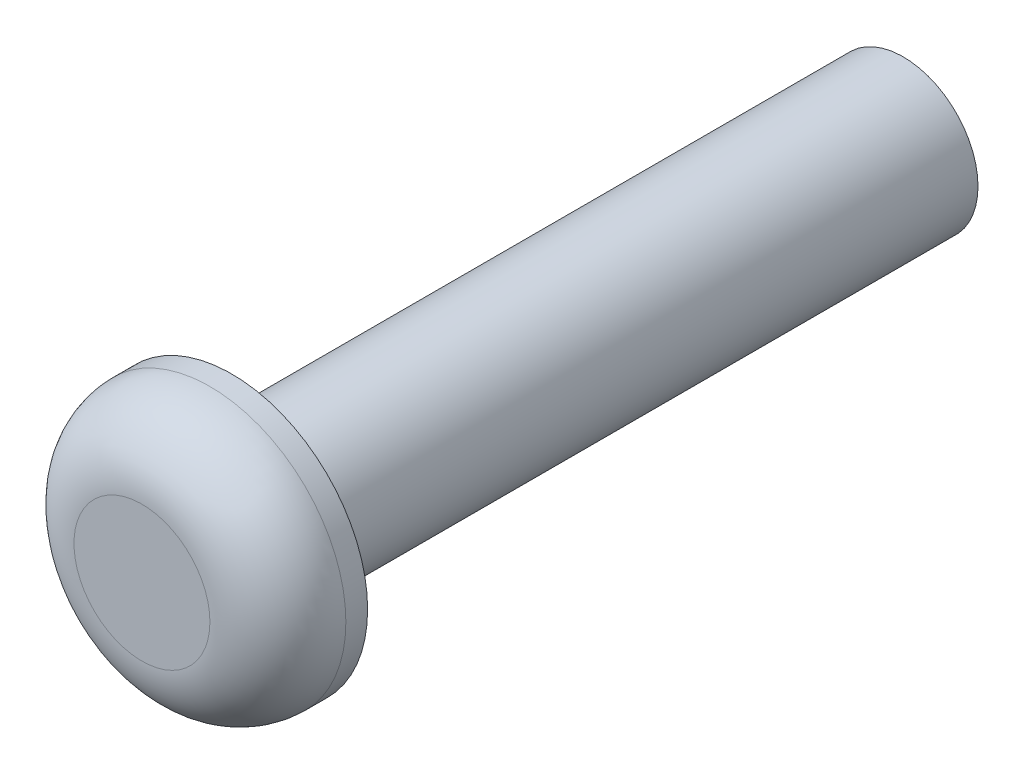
SolidWorks part; units mm, degrees
ref_plane "Front Plane" through (0, 0, 0) normal (0, 0, 1) x (1, 0, 0)
ref_plane "Top Plane" through (0, 0, 0) normal (0, 1, 0) x (1, 0, 0)
ref_plane "Right Plane" through (0, 0, 0) normal (1, 0, 0) x (0, 0, -1)
sketch "Sketch1" plane through (0, 0, 0) normal (0, 0, 1) x (1, 0, 0)
  circle A0 centre (0, 0) radius 2.54
  dimension "D1" = 5.08
extrude "Boss-Extrude1" add sketch "Sketch1" along normal blind 1.6764
sketch "Sketch3" plane through (0, 0, 1.6764) normal (0, 0, 1) x (1, 0, 0)
  circle A0 centre (0, 0) radius 1.397
  dimension "D1" = 2.794
extrude "Boss-Extrude2" add sketch "Sketch3" against normal blind 14.224
fillet "Fillet1" radius 1.27 1 edges at (2.54, 0, 1.6764)
